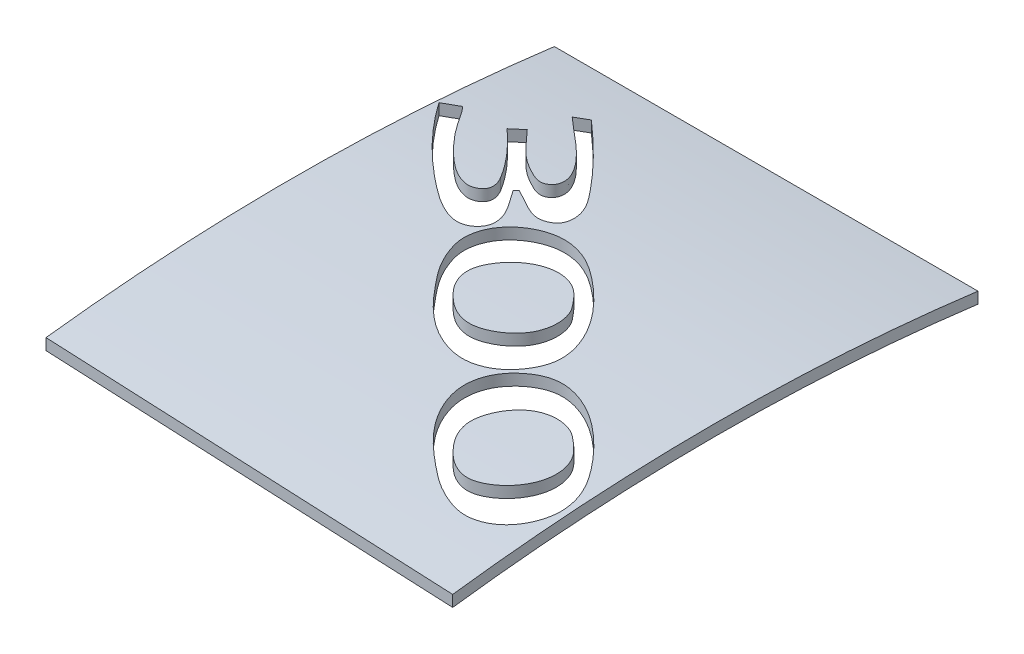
SolidWorks part; units mm, degrees
ref_plane "Front Plane" through (0, 0, 0) normal (0, 0, 1) x (1, 0, 0)
ref_plane "Top Plane" through (0, 0, 0) normal (0, 1, 0) x (1, 0, 0)
ref_plane "Right Plane" through (0, 0, 0) normal (1, 0, 0) x (0, 0, -1)
sketch "Sketch1" plane through (0, 0, 0) normal (0, 1, 0) x (1, 0, 0)
  line L0 (0, 0) -> (0, 71.4375)
  line L1 (0, 71.4375) -> (59.5312, 71.4375)
  line L2 (59.5312, 71.4375) -> (59.5312, -2.3813)
  line L3 (59.5312, -2.3813) -> (0, 0)
  dimension "D1" = 71.4375
  dimension "D2" = 73.8188
  dimension "D3" = 59.5312
extrude "Boss-Extrude1" add sketch "Sketch1" along normal blind 25.4
sketch "Sketch4" plane through (0, 25.4, 0) normal (0, 1, 0) x (1, 0, 0)
  line L0 (137.2023, 57.9419) -> (416.2738, -221.1296) construction
sketch "Sketch8" plane through (59.5312, 0, 0) normal (1, 0, 0) x (0, 0, -1)
  line L0 (-2.3813, 25.4) -> (-2.3813, 23.0187)
  line L1 (-2.3813, 25.4) -> (-2.3813, 0) construction
  line L2 (71.4375, 25.4) -> (71.4375, 23.0187)
  line L3 (71.4375, 25.4) -> (71.4375, 0) construction
  line L4 (-2.3813, 25.4) -> (71.4375, 25.4)
  line L5 (-2.3813, 23.0187) -> (-2.3813, 21.4312)
  line L6 (71.4375, 23.0187) -> (71.4375, 21.4312)
  line L7 (-2.3813, 21.4312) -> (-2.3813, 0)
  line L8 (-2.3813, 0) -> (71.4375, 0)
  line L9 (71.4375, 0) -> (71.4375, 21.4312)
  line L11 (-2.3813, 25.4) -> (71.4375, 25.4)
  line L12 (-2.3813, 25.4) -> (-2.3813, 0)
  line L13 (-2.3813, 0) -> (71.4375, 0)
  line L14 (71.4375, 25.4) -> (71.4375, 0)
  arc A0 (-2.3813, 23.0187) -> (71.4375, 23.0187) centre (34.5281, -261.8383) cw
  arc A1 (-2.3813, 21.4312) -> (71.4375, 21.4312) centre (34.5281, -263.4258) cw
  dimension "D1" = 2.3812
  dimension "D2" = 2.3812
  dimension "D3" = 1.5875
  dimension "D4" = 1.5875
sketch "Sketch5" plane through (0, 25.4, 0) normal (0, 1, 0) x (1, 0, 0)
  line L0 (0.382, 54.8346) -> (2.4246, 56.1402)
  line L1 (8.2133, 56.5841) -> (9.6296, 58.0004)
  line L2 (10.788, 63.1586) -> (12.3727, 64.2654)
  line L3 (17.0664, 49.4408) -> (16.6323, 49.0067)
  line L7 (29.7656, -1.1906) -> (29.7656, 17.5987) construction
  line L8 (0, 0) -> (59.5312, -2.3813) construction
  line L9 (29.7656, 17.5987) -> (48.2878, 36.1209) construction
  spline S0 degree 3 poles (12.3727, 64.2654) (15.921, 61.084) (20.2112, 56.9132) (24.2643, 51.4653) (24.4878, 48.1373) (22.1275, 47.0728) (19.6806, 47.8066) (18.2434, 48.869) (17.0664, 49.4408) knots 0 0 0 0 0.510689 0.631004 0.731222 0.81114 0.860174 1 1 1 1
  spline S1 degree 2 poles (0.382, 54.8346) (5.4617, 47.772) (12.6957, 42.634) knots 0 0 0 1 1 1
  spline S2 degree 3 poles (12.6957, 42.634) (14.0801, 41.7534) (17.0385, 39.9722) (19.3585, 42.3397) (19.7014, 45.4217) (17.5805, 47.496) (16.6323, 49.0067) knots 0 0 0 0 0.369556 0.528182 0.57402 1 1 1 1
  spline S3 degree 3 poles (2.4246, 56.1402) (3.209, 55.2793) (4.507, 53.1073) (6.8121, 50.3883) (9.2121, 48.0792) (11.3348, 46.6301) (13.4465, 46.1917) (15.2423, 47.5817) (14.5009, 49.2043) (14.1142, 49.7878) knots 0 0 0 0 0.181052 0.394102 0.554939 0.700276 0.793451 0.871366 1 1 1 1
  spline S4 degree 3 poles (14.1142, 49.7878) (12.508, 52.3315) (10.4269, 54.5629) (8.2133, 56.5841) knots 0 0 0 0 1 1 1 1
  spline S5 degree 3 poles (9.6296, 58.0004) (10.9606, 56.5894) (12.7319, 54.3758) (15.571, 52.6767) (17.5353, 51.7985) (18.747, 52.897) (18.9262, 54.178) (18.2933, 55.8597) (15.7571, 59.1631) (12.7893, 61.3171) (10.788, 63.1586) knots 0 0 0 0 0.237234 0.325278 0.41433 0.458554 0.50043 0.563505 0.669793 1 1 1 1
  spline S6 degree 3 poles (27.3926, 30.0249) (25.7228, 31.4368) (24.2064, 33.0511) (23.2253, 35.4946) (24.2054, 38.2602) (25.7824, 40.2097) (27.9215, 41.6243) (30.3627, 42.1246) (33.0484, 41.315) (34.5112, 39.6461) (35.8949, 37.9398) (36.5357, 35.6545) (35.9037, 32.8989) (34.095, 30.93) (32.1649, 29.8013) (29.7151, 29.1957) (27.3926, 30.0249) (25.7228, 31.4368) (24.2064, 33.0511) knots -0.179356 -0.127697 -0.049131 0 0.042085 0.123433 0.187573 0.260168 0.315816 0.384088 0.446927 0.523961 0.551921 0.6176 0.70017 0.759614 0.820644 0.872303 0.950869 1 1.042085 1.123433 1.187573 only from (25.6812, 31.5229) to (25.6812, 31.5229)
  spline S7 degree 3 poles (24.7407, 29.6179) (22.8412, 31.9145) (21.0258, 34.2161) (19.8106, 36.6447) (18.9586, 39.6933) (19.8525, 43.3839) (22.7959, 45.7925) (26.1828, 46.7478) (29.5676, 46.0967) (33.3414, 43.5798) (36.9342, 40.2347) (40.0633, 35.9291) (41.3832, 31.2189) (39.538, 27.663) (37.2016, 25.4834) (33.9094, 24.4779) (30.3015, 25.3378) (27.149, 27.2731) (24.7407, 29.6179) (22.8412, 31.9145) (21.0258, 34.2161) knots -0.15284 -0.095013 -0.041367 0 0.041312 0.092344 0.123073 0.184735 0.252934 0.286141 0.343576 0.40302 0.492063 0.566126 0.647266 0.697078 0.741053 0.791055 0.84716 0.904987 0.958633 1 1.041312 1.092344 1.123073 only from (22.8478, 31.923) to (22.8478, 31.923)
  spline S8 degree 3 poles (41.7848, 12.5738) (44.0814, 10.6743) (46.383, 8.8589) (48.8116, 7.6437) (51.8602, 6.7917) (55.5508, 7.6856) (57.9594, 10.629) (58.9147, 14.0159) (58.2636, 17.4007) (55.7467, 21.1745) (52.4016, 24.7673) (48.096, 27.8964) (43.3858, 29.2163) (39.8299, 27.3711) (37.6503, 25.0347) (36.6448, 21.7425) (37.5047, 18.1346) (39.44, 14.9821) (41.7848, 12.5738) (44.0814, 10.6743) (46.383, 8.8589) knots -0.15284 -0.095013 -0.041367 0 0.041312 0.092344 0.123073 0.184735 0.252934 0.286141 0.343576 0.40302 0.492063 0.566126 0.647266 0.697078 0.741053 0.791055 0.84716 0.904987 0.958633 1 1.041312 1.092344 1.123073 only from (44.0899, 10.6809) to (44.0899, 10.6809)
  spline S9 degree 3 poles (42.1917, 15.2257) (43.6037, 13.5559) (45.218, 12.0395) (47.6615, 11.0584) (50.4271, 12.0385) (52.3766, 13.6155) (53.7912, 15.7546) (54.2915, 18.1958) (53.4819, 20.8815) (51.813, 22.3443) (50.1067, 23.728) (47.8214, 24.3688) (45.0658, 23.7368) (43.0969, 21.9281) (41.9682, 19.998) (41.3626, 17.5482) (42.1917, 15.2257) (43.6037, 13.5559) (45.218, 12.0395) knots -0.179356 -0.127697 -0.049131 0 0.042085 0.123433 0.187573 0.260168 0.315816 0.384088 0.446927 0.523961 0.551921 0.6176 0.70017 0.759614 0.820644 0.872303 0.950869 1 1.042085 1.123433 1.187573 only from (43.6898, 13.5143) to (43.6898, 13.5143)
  point P58 (30.0569, 18.0311)
  point P62 (29.7656, 17.5987)
  point P70 (0, 0)
  point P78 (38.9941, 27.0902)
  dimension "D1" = 135
extrude "Cut-Extrude1" cut sketch "Sketch5" against normal through all
extrude "Cut-Extrude6" cut sketch "Sketch8" against normal through all contours A0 L11 M8 | A0 M7 M6 | A1 M8 M5 M6
sketch "Sketch9" plane through (59.5312, 0, 0) normal (1, 0, 0) x (0, 0, -1)
  line L1 (-2.3813, 33.1603) -> (72.539, 33.1603)
  line L2 (71.4375, 21.4313) -> (71.4375, 23.0187)
  line L3 (-2.3813, 23.0187) -> (-2.3813, 21.4313)
  line L4 (71.4375, 21.4313) -> (71.4375, 23.0187)
  line L5 (-2.3813, 23.0187) -> (-2.3813, 21.4313)
  line L6 (-2.3813, 33.1603) -> (-2.3813, -3.8293)
  line L7 (-2.3813, -3.8293) -> (72.539, -3.8293)
  line L8 (72.539, 33.1603) -> (72.539, -3.8293)
  arc A2 (71.4375, 21.4313) -> (-2.3813, 21.4313) centre (34.5281, -263.4258) ccw
  arc A3 (71.4375, 23.0187) -> (-2.3813, 23.0187) centre (34.5281, -261.8383) ccw
  arc A4 (71.4375, 21.4313) -> (-2.3813, 21.4313) centre (34.5281, -263.4258) ccw
  arc A5 (71.4375, 23.0187) -> (-2.3813, 23.0187) centre (34.5281, -261.8383) ccw
  dimension "D1" = 0
extrude "Cut-Extrude7" cut sketch "Sketch9" against normal through all contours L8 L1 L6 L7 M7 M6 M5
